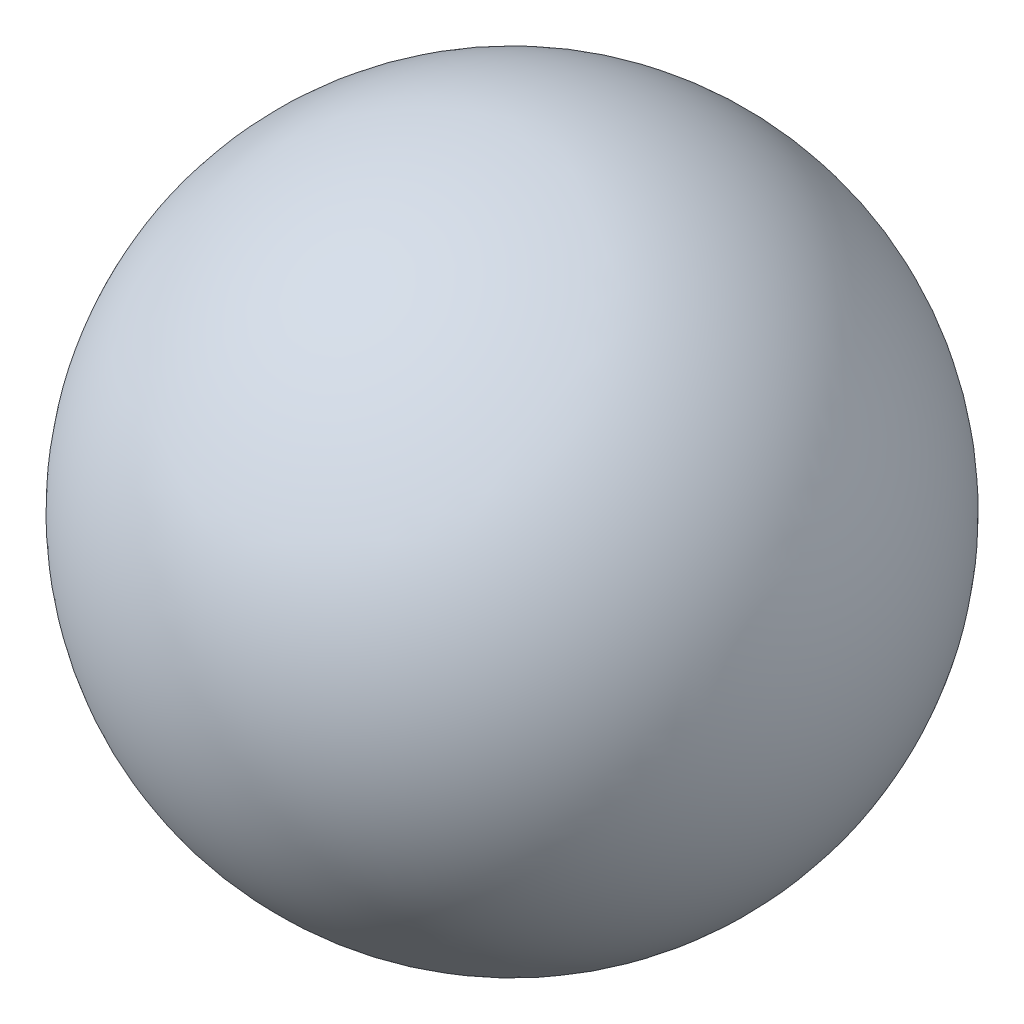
SolidWorks part; units mm, degrees
ref_plane "Front Plane" through (0, 0, 0) normal (0, 0, 1) x (1, 0, 0)
ref_plane "Top Plane" through (0, 0, 0) normal (0, 1, 0) x (1, 0, 0)
ref_plane "Right Plane" through (0, 0, 0) normal (1, 0, 0) x (0, 0, -1)
ref_plane "Plane1" through (0, 0, 11.844) normal (0, 0, 1) x (1, 0, 0)
sketch "Sketch1" plane through (0, 0, 11.844) normal (0, 0, 1) x (1, 0, 0)
  line L0 (-3.969, 11.844) -> (3.969, 11.844)
  line L1 (-3.969, 11.844) -> (3.969, 11.844) construction
  arc A0 (3.969, 11.844) -> (-3.969, 11.844) centre (0, 11.844) ccw
revolve "Revolve1" add sketch "Sketch1" angle 360 about L1
sketch "Sketch2" plane through (0, 0, 0) normal (1, 0, 0) x (0, 0, -1)
  line L0 (-7.875, 11.844) -> (-15.813, 11.844) construction
  circle A0 centre (-11.844, 11.844) radius 3.969 construction
